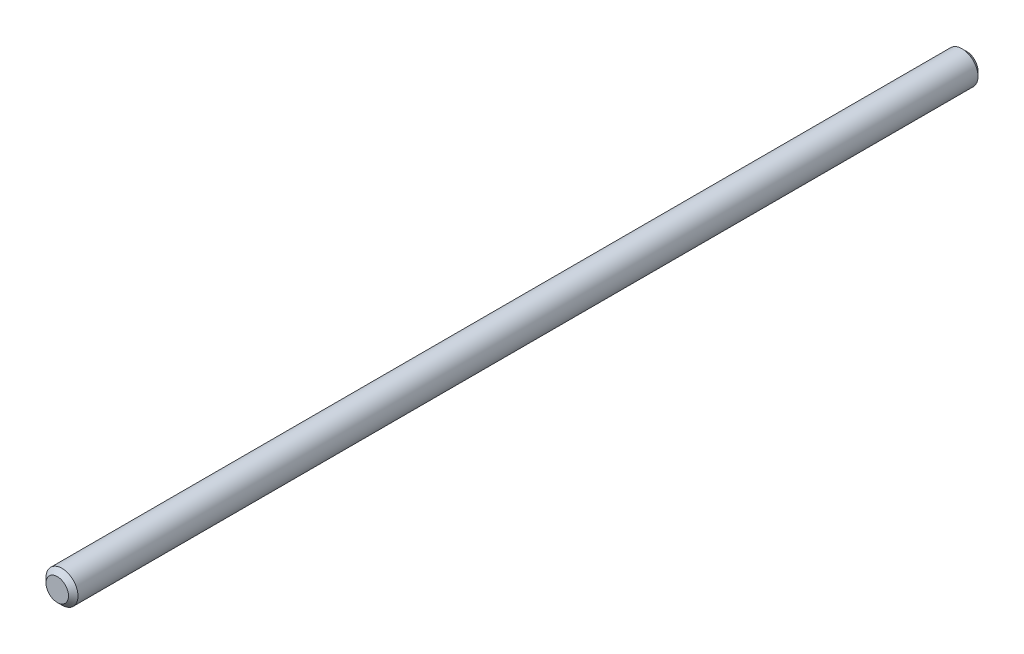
SolidWorks part; units mm, degrees
ref_plane "Front Plane" through (0, 0, 0) normal (0, 0, 1) x (1, 0, 0)
ref_plane "Top Plane" through (0, 0, 0) normal (0, 1, 0) x (1, 0, 0)
ref_plane "Right Plane" through (0, 0, 0) normal (1, 0, 0) x (0, 0, -1)
sketch "Sketch1" plane through (0, 0, 0) normal (1, 0, 0) x (0, 0, -1)
  line L0 (0, 0) -> (87.4739, 0) construction
  line L1 (0, 0) -> (0, 5.3581)
  line L2 (0, 5.3581) -> (-304.8, 5.3581)
  line L3 (-304.8, 5.3581) -> (-304.8, 0)
  line L4 (-304.8, 0) -> (0, 0)
  dimension "D1" = 10.7163
  dimension "D2" = 304.8
revolve "Revolve1" add sketch "Sketch1" angle 360 about L0
chamfer "Chamfer1" distance 1.5875 angle 45 2 edges at (5.3581, 0, 304.8) (5.3581, 0, 0)
